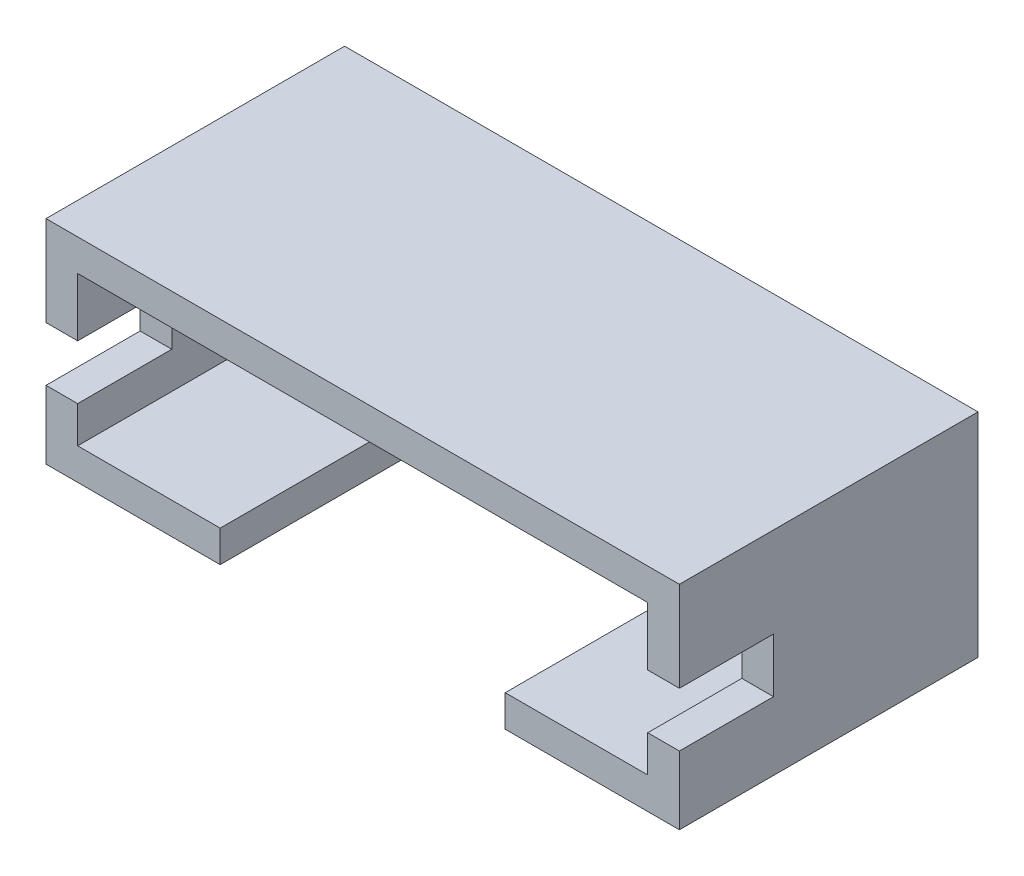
SolidWorks part; units mm, degrees
ref_plane "Face" through (0, 0, 0) normal (0, 0, 1) x (1, 0, 0)
ref_plane "Dessus" through (0, 0, 0) normal (0, 1, 0) x (1, 0, 0)
ref_plane "Droite" through (0, 0, 0) normal (1, 0, 0) x (0, 0, -1)
sketch "Esquisse1" plane through (0, 0, 0) normal (0, 0, 1) x (1, 0, 0)
  line L1 (20.2272, 0) -> (34.2272, 0)
  line L2 (20.2272, 0) -> (20.2272, 4.7)
  line L3 (20.2272, 4.7) -> (34.2272, 4.7)
  line L4 (34.2272, 0) -> (34.2272, 4.7)
  dimension "D1" = 4.7
  dimension "D2" = 14
extrude "Extrusion1" add sketch "Esquisse1" along normal blind 6.6
shell "Coque1" thickness 0.7
sketch "Esquisse2" plane through (34.2272, 0, 0) normal (1, 0, 0) x (0, 0, -1)
  line L0 (-6.6, 0) -> (-6.6, 4.7) construction
  line L1 (-6.6, 1.5086) -> (-4.5204, 1.5086)
  line L2 (-6.6, 1.5086) -> (-6.6, 2.7086)
  line L3 (-6.6, 2.7086) -> (-4.5204, 2.7086)
  line L4 (-4.5204, 1.5086) -> (-4.5204, 2.7086)
  line L5 (0, 2.35) -> (-5.6635, 2.35) construction
  line L6 (0, 0) -> (0, 4.7) construction
  dimension "D1" = 1.2
  dimension "D2" = 2.0796
extrude "Enlèv. mat.-Extru.1" cut sketch "Esquisse2" against normal through all
sketch "Esquisse3" plane through (0, 0, 0) normal (0, -1, 0) x (1, 0, 0)
  line L0 (20.2272, 6.6) -> (34.2272, 6.6) construction
  line L1 (24.0772, 6.6) -> (30.3772, 6.6)
  line L2 (24.0772, 6.6) -> (24.0772, 1.1619)
  line L3 (24.0772, 1.1619) -> (30.3772, 1.1619)
  line L4 (30.3772, 6.6) -> (30.3772, 1.1619)
  line L5 (27.2272, 0) -> (27.2272, 4.8072) construction
  line L6 (20.2272, 0) -> (34.2272, 0) construction
  point P6 (27.2272, 6.6)
  dimension "D1" = 6.3
extrude "Enlèv. mat.-Extru.2" cut sketch "Esquisse3" against normal up to next
sketch "Esquisse4" plane through (0, 0, 0.7) normal (0, 0, 1) x (1, 0, 0)
  line L0 (20.9272, 2.35) -> (34.921, 2.35) construction
  line L1 (20.9272, 4) -> (20.9272, 0.7) construction
  line L2 (27.2272, 4) -> (27.2272, 1.339) construction
  line L3 (33.5272, 4) -> (20.9272, 4) construction
  circle A0 centre (26.072, 2.35) radius 0.3029
  circle A1 centre (28.2694, 2.35) radius 0.3029
  circle A2 centre (30.4669, 2.35) radius 0.3029
  circle A3 centre (24.2694, 2.35) radius 0.3029
  circle A4 centre (22.2352, 2.35) radius 0.3029
  circle A5 centre (32.2352, 2.35) radius 0.3029
  dimension "D1" = 10
extrude "Extrusion2" add sketch "Esquisse4" along normal blind 3 and the other way blind 2
